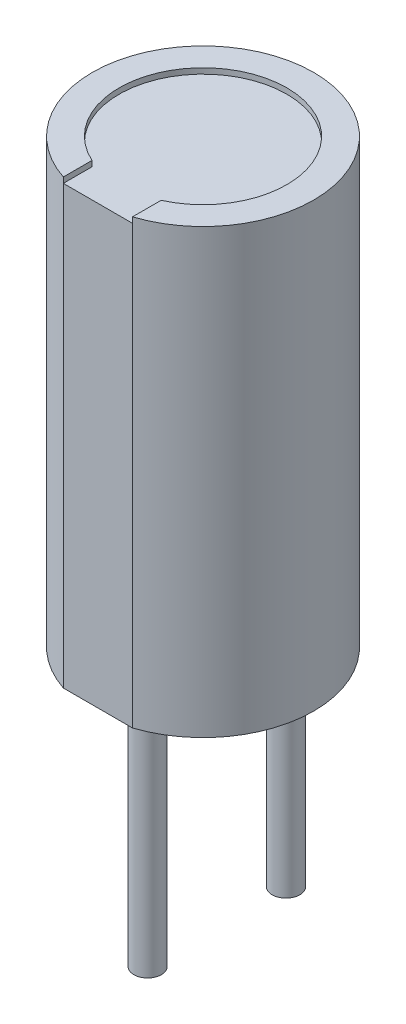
SolidWorks part; units mm, degrees
ref_plane "Plan de face" through (0, 0, 0) normal (0, 0, 1) x (1, 0, 0)
ref_plane "Plan de dessus" through (0, 0, 0) normal (0, 1, 0) x (1, 0, 0)
ref_plane "Plan de droite" through (0, 0, 0) normal (1, 0, 0) x (0, 0, -1)
sketch "Esquisse1" plane through (0, 0, 0) normal (0, 1, 0) x (1, 0, 0)
  circle A0 centre (0, 0) radius 2
  dimension "D1" = 4
extrude "Extrusion1" add sketch "Esquisse1" along normal blind 8
ref_plane "Plan1" through (0, 0, 2) normal (0, 0, 1) x (1, 0, 0)
sketch "Esquisse2" plane through (0, 0, 2) normal (0, 0, 1) x (1, 0, 0)
  line L0 (-2, 0) -> (2, 0) construction
  line L1 (-1, 0) -> (1, 0)
  line L2 (-1, 0) -> (-1, 8)
  line L3 (-1, 8) -> (1, 8)
  line L4 (1, 0) -> (1, 8)
  line L5 (2, 8) -> (-2, 8) construction
  dimension "D1" = 2
extrude "Enlèv. mat.-Extru.1" cut sketch "Esquisse2" against normal blind 0.1
sketch "Esquisse3" plane through (0, 0, 0) normal (0, -1, 0) x (1, 0, 0)
  circle A0 centre (0, 1) radius 0.25
  circle A1 centre (0, -1.5) radius 0.25
  dimension "D3" = 0.5
  dimension "D1" = 2.5
  dimension "D2" = 1
extrude "Extrusion2" add sketch "Esquisse3" along normal blind 4.5
sketch "Esquisse4" plane through (0, 8, 0) normal (0, 1, 0) x (-1, 0, 0)
  line L0 (-0.6245, 1.3814) -> (-0.6245, 1.9)
  line L1 (0.6245, 1.3814) -> (0.6245, 1.9)
  line L2 (0.6245, 1.9) -> (-0.6245, 1.9)
  arc A0 (-0.6245, 1.3814) -> (0.6245, 1.3814) centre (0, 0) ccw
extrude "Enlèv. mat.-Extru.2" cut sketch "Esquisse4" against normal blind 0.1
